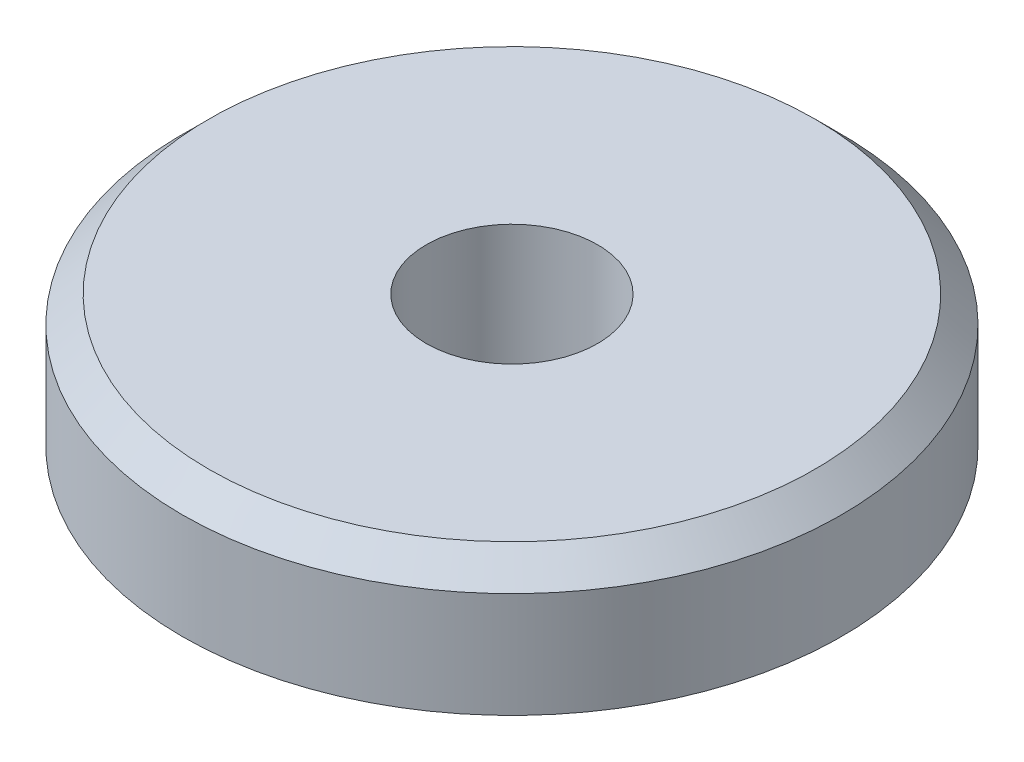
SolidWorks part; units mm, degrees
ref_plane "Plan de face" through (0, 0, 0) normal (0, 0, 1) x (1, 0, 0)
ref_plane "Plan de dessus" through (0, 0, 0) normal (0, 1, 0) x (1, 0, 0)
ref_plane "Plan de droite" through (0, 0, 0) normal (1, 0, 0) x (0, 0, -1)
sketch "Esquisse1" plane through (0, 0, 0) normal (0, 1, 0) x (1, 0, 0)
  circle A0 centre (0, 0) radius 12.5
  circle A1 centre (0, 0) radius 3.25
  dimension "D1" = 25
  dimension "D2" = 6.5
extrude "Extrusion1" add sketch "Esquisse1" along normal blind 5
chamfer "Chanfrein1" distance 1 angle 45 1 edges at (0, 5, 12.5)
